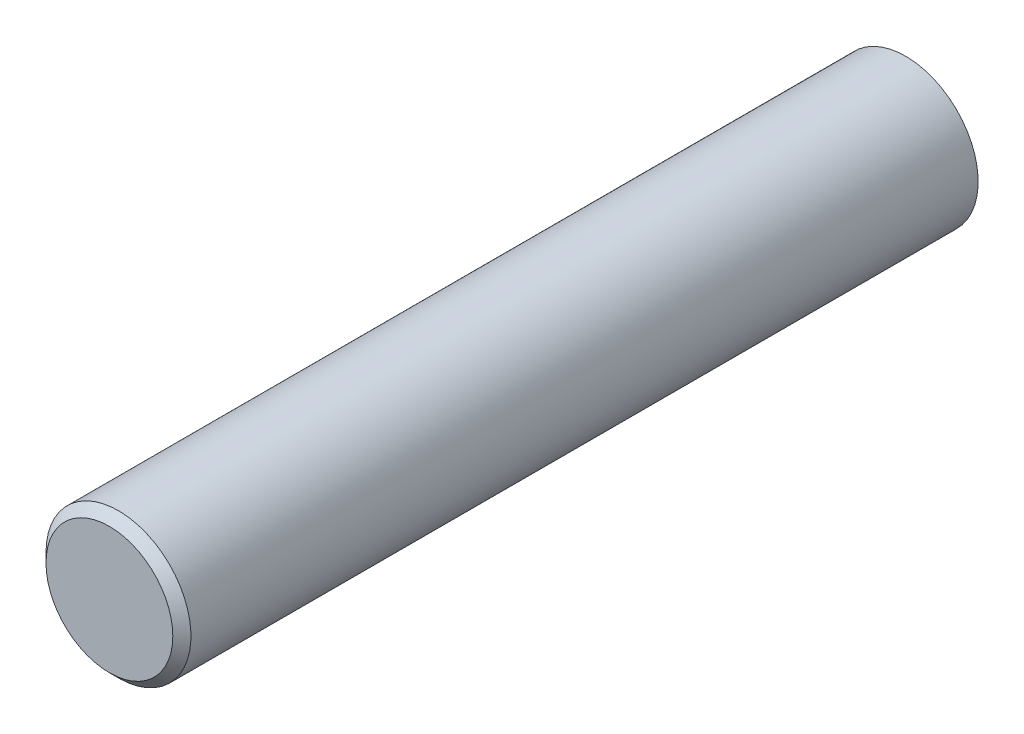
SolidWorks part; units mm, degrees
ref_plane "Plan de face" through (0, 0, 0) normal (0, 0, 1) x (1, 0, 0)
ref_plane "Plan de dessus" through (0, 0, 0) normal (0, 1, 0) x (1, 0, 0)
ref_plane "Plan de droite" through (0, 0, 0) normal (1, 0, 0) x (0, 0, -1)
sketch "Esquisse1" plane through (0, 0, 0) normal (0, 0, 1) x (1, 0, 0)
  circle A0 centre (0, 0) radius 8
  dimension "D1" = 16
extrude "Boss.-Extru.1" add sketch "Esquisse1" along normal blind 90
sketch "Esquisse3" plane through (0, 0, 0) normal (1, 0, 0) x (0, 0, -1)
  line L0 (0, 8) -> (-90, 8) construction
  line L1 (0, -8) -> (0, 8) construction
  line L2 (0, 8) -> (-2.0863, 8)
  line L3 (0, 0.1) -> (0, 8)
  line L5 (0, 0) -> (-15.418, 0) construction
  arc A0 (0, 0.1) -> (-2.0863, 8) centre (-16, 0.1) ccw
  dimension "D1" = 0.1
  dimension "D2" = 32
revolve "Enlèvement de matière-Révolution1" cut sketch "Esquisse3" angle 360 about L5
chamfer "Chanfrein1" distance 1 angle 45 1 edges at (8, 0, 90)
